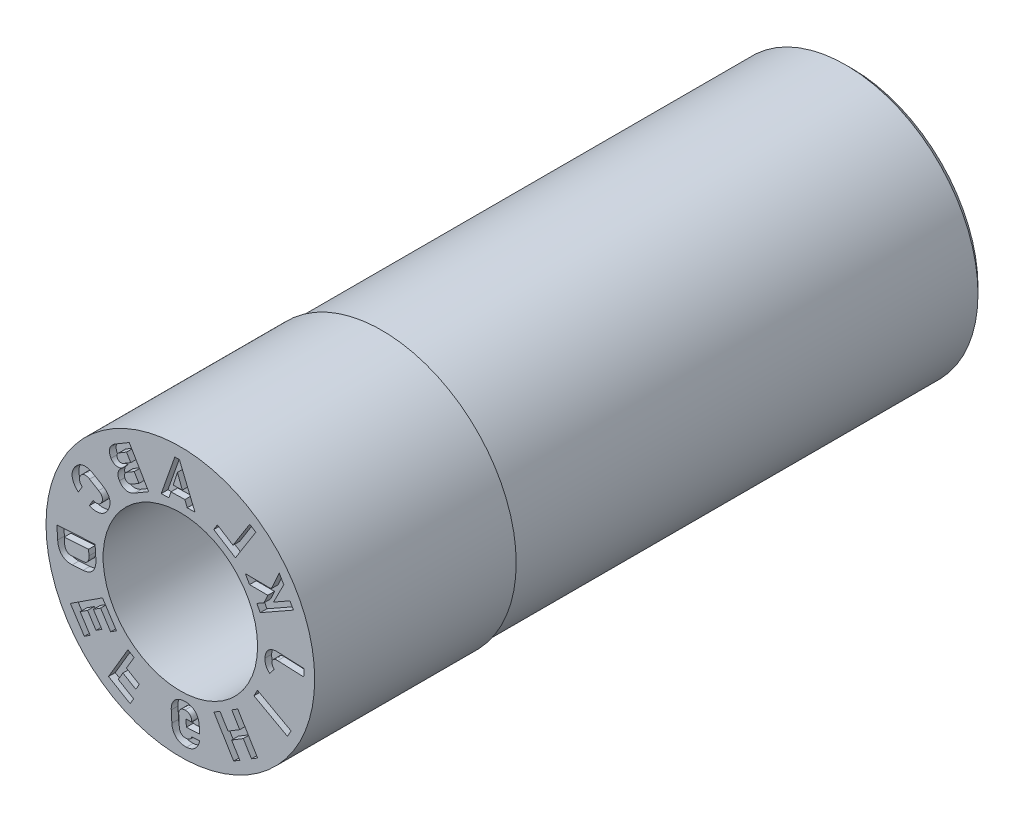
SolidWorks part; units mm, degrees
ref_plane "Front Plane" through (0, 0, 0) normal (0, 0, 1) x (1, 0, 0)
ref_plane "Top Plane" through (0, 0, 0) normal (0, 1, 0) x (1, 0, 0)
ref_plane "Right Plane" through (0, 0, 0) normal (1, 0, 0) x (0, 0, -1)
sketch "Sketch1" plane through (0, 0, 0) normal (1, 0, 0) x (0, 0, -1)
  line L2 (0, 4) -> (0, 2.3)
  line L3 (19.75, 4) -> (0, 4)
  line L4 (-3.7979, 0) -> (49996.2021, 0) construction
  line L8 (16, 1.25) -> (4, 1.25)
  line L9 (4, 2.3) -> (4, 1.25)
  line L10 (4, 2.3) -> (0, 2.3)
  line L12 (20, 2) -> (20, 3.75)
  line L16 (20, 3.75) -> (19.75, 4)
  line L17 (20, 2) -> (16, 2)
  line L18 (16, 1.25) -> (16, 2)
  dimension "D1" = 20
  dimension "D2" = 45
  dimension "D3" = 0.25
  dimension "D4" = 8
  dimension "D5" = 4.6
  dimension "D6" = 4
  dimension "D7" = 2.5
  dimension "D8" = 4
  dimension "D9" = 4
revolve "Revolve1" add sketch "Sketch1" angle 360 about L4
sketch "Sketch4" plane through (0, 0, 0) normal (1, 0, 0) x (0, 0, -1)
  line L0 (0, 0) -> (50000, 0) construction
  line L1 (20, -3.75) -> (20, 3.75) construction
  line L2 (6, 4.935) -> (20, 4.935)
  line L3 (6, 4.935) -> (6, 3.935)
  line L4 (6, 3.935) -> (20, 3.935)
  line L5 (20, 4.935) -> (20, 3.935)
  line L6 (19.75, 4) -> (0, 4) construction
  line L9 (0, 4.4) -> (0, -4.4) construction
  dimension "D1" = 1
  dimension "D2" = 0.065
  dimension "D3" = 6
revolve "Cut-Revolve1" cut sketch "Sketch4" angle 360 about L0
sketch "Sketch2" plane through (0, 0, 0) normal (0, 0, 1) x (1, 0, 0)
  line L0 (0, 0) -> (0, 4) construction
  line L1 (0, 0) -> (2, 3.4641) construction
  line L2 (0, 0) -> (3.4641, 2) construction
  line L3 (0, 0) -> (4, 0) construction
  line L4 (0, 0) -> (3.4641, -2) construction
  line L5 (0, 0) -> (2, -3.4641) construction
  line L6 (0, 0) -> (0, -4) construction
  line L7 (0, 0) -> (-2, -3.4641) construction
  line L8 (0, 0) -> (-3.4641, -2) construction
  line L9 (0, 0) -> (-4, 0) construction
  line L10 (0, 0) -> (-3.4641, 2) construction
  line L11 (0, 0) -> (-2, 3.4641) construction
  line L12 (2.7731, 1.3778) -> (3.0799, 1.9775)
  line L13 (3.0799, 1.9775) -> (2.9468, 2.2119)
  line L14 (2.9468, 2.2119) -> (2.7051, 1.687)
  line L16 (3.3681, 1.4693) -> (3.2625, 1.6554)
  line L17 (3.2625, 1.6554) -> (2.7731, 1.3778)
  line L18 (2.2747, 1.095) -> (2.3803, 0.9089)
  line L19 (2.3803, 0.9089) -> (3.3681, 1.4693)
  line L20 (2.605, 1.4696) -> (2.4884, 1.2163)
  line L21 (2.7051, 1.687) -> (1.9356, 1.6931)
  line L22 (1.9356, 1.6931) -> (2.0608, 1.472)
  line L23 (2.0608, 1.472) -> (2.605, 1.4696)
  line L24 (2.2469, 2.9172) -> (2.0651, 3.0316)
  line L25 (2.0651, 3.0316) -> (1.5681, 2.2422)
  line L26 (-1.3719, 2.6709) -> (-1.2331, 2.4354)
  line L27 (1.6396, 1.9527) -> (2.2469, 2.9172)
  line L28 (1.5681, 2.2422) -> (1.1035, 2.5346)
  line L29 (1.1035, 2.5346) -> (0.9932, 2.3594)
  line L30 (0.9932, 2.3594) -> (1.6396, 1.9527)
  line L31 (-2.5891, -1.491) -> (-2.3746, -1.3517)
  line L32 (-0.0282, 3.6543) -> (-0.1641, 3.6508)
  line L33 (-0.1641, 3.6508) -> (-0.5697, 2.5041)
  line L34 (-0.5697, 2.5041) -> (-0.3392, 2.5099)
  line L35 (-0.3392, 2.5099) -> (-0.2801, 2.6935)
  line L36 (-0.0872, 3.2923) -> (0.0585, 2.9084)
  line L37 (0.2045, 2.5238) -> (0.4348, 2.5296)
  line L38 (0.4348, 2.5296) -> (-0.0282, 3.6543)
  line L39 (0.0585, 2.9084) -> (-0.2131, 2.9016)
  line L40 (-0.2131, 2.9016) -> (-0.0872, 3.2923)
  line L41 (-0.2801, 2.6935) -> (0.1361, 2.704)
  line L42 (0.1361, 2.704) -> (0.2045, 2.5238)
  line L43 (-1.2331, 2.4354) -> (-1.4418, 2.3125)
  line L44 (-1.6433, 2.3507) -> (-1.6446, 2.3528)
  line L45 (-1.5807, 2.548) -> (-1.3719, 2.6709)
  line L46 (-1.6059, -2.5148) -> (-1.3767, -2.1264)
  line L47 (-1.4768, 2.8488) -> (-1.6856, 2.7259)
  line L48 (-1.8093, 2.9358) -> (-1.6005, 3.0587)
  line L49 (1.8746, -2.5902) -> (2.1183, -2.9904)
  line L50 (-1.5209, 3.3453) -> (-1.9201, 3.1101)
  line L51 (-1.814, 2.2157) -> (-1.8128, 2.2137)
  line L52 (-1.3548, 2.1244) -> (-0.944, 2.3664)
  line L53 (1.42, -2.6262) -> (1.1811, -2.2339)
  line L54 (2.4884, 1.2163) -> (2.2747, 1.095)
  line L55 (-1.6005, 3.0587) -> (-1.4768, 2.8488)
  line L57 (-0.944, 2.3664) -> (-1.5209, 3.3453)
  line L58 (-2.3192, 1.8411) -> (-2.5877, 2.0013)
  line L59 (-3.0357, 1.3127) -> (-2.9216, 1.5042)
  line L60 (-2.7017, 1.8101) -> (-2.4332, 1.65)
  line L61 (-2.5985, 1.3114) -> (-2.7125, 1.1199)
  line L62 (-2.7321, -0.013) -> (-2.7216, -0.1795)
  line L63 (-2.902, -0.4133) -> (-3.2368, -0.4346)
  line L64 (-3.4457, -0.2256) -> (-3.4563, -0.0589)
  line L67 (-3.2167, -0.6562) -> (-2.8943, -0.6357)
  line L68 (-2.5154, -0.1609) -> (-2.5391, 0.2145)
  line L70 (-3.6762, 0.1423) -> (-3.6524, -0.2338)
  line L71 (-3.4563, -0.0589) -> (-2.7321, -0.013)
  line L73 (-2.5391, 0.2145) -> (-3.6762, 0.1423)
  line L75 (-2.9839, -1.7475) -> (-2.7628, -1.6039)
  line L77 (-2.318, -1.0584) -> (-3.2746, -1.6798)
  line L78 (-2.3746, -1.3517) -> (-2.0754, -1.8122)
  line L79 (-2.0754, -1.8122) -> (-1.9017, -1.6993)
  line L80 (-1.9017, -1.6993) -> (-2.318, -1.0584)
  line L82 (-2.7628, -1.6039) -> (-2.5106, -1.9921)
  line L83 (-2.5106, -1.9921) -> (-2.337, -1.8792)
  line L84 (-2.337, -1.8792) -> (-2.5891, -1.491)
  line L86 (-3.2746, -1.6798) -> (-2.8584, -2.3207)
  line L87 (-2.8584, -2.3207) -> (-2.6848, -2.2079)
  line L88 (-2.6848, -2.2079) -> (-2.9839, -1.7475)
  line L91 (-1.8492, -2.9273) -> (-1.7106, -2.6924)
  line L92 (-1.3767, -2.1264) -> (-1.5611, -2.0177)
  line L93 (-1.5611, -2.0177) -> (-2.1385, -2.9963)
  line L94 (-1.7106, -2.6924) -> (-1.3262, -2.9191)
  line L95 (-1.3262, -2.9191) -> (-1.2213, -2.7416)
  line L96 (-1.2213, -2.7416) -> (-1.6059, -2.5148)
  line L98 (-2.1385, -2.9963) -> (-1.4959, -3.3755)
  line L99 (-1.4959, -3.3755) -> (-1.3909, -3.1977)
  line L100 (-1.3909, -3.1977) -> (-1.8492, -2.9273)
  line L102 (0.5732, -3.1262) -> (0.5618, -2.9043)
  line L103 (-0.2704, -2.9224) -> (-0.253, -3.2574)
  line L104 (0.5728, -3.3015) -> (0.3417, -3.3136)
  line L105 (-0.0314, -3.246) -> (-0.0487, -2.911)
  line L106 (0.3396, -2.9129) -> (0.3407, -2.9316)
  line L107 (0.3407, -2.9316) -> (0.169, -2.9405)
  line L108 (0.169, -2.9405) -> (0.1796, -3.1466)
  line L109 (0.1796, -3.1466) -> (0.5732, -3.1262)
  line L110 (2.1183, -2.9904) -> (2.3005, -2.8793)
  line L111 (2.3005, -2.8793) -> (1.7109, -1.9112)
  line L112 (1.7109, -1.9112) -> (1.5287, -2.0222)
  line L113 (1.5287, -2.0222) -> (1.7676, -2.4144)
  line L114 (1.5882, -3.3133) -> (1.7707, -3.2021)
  line L115 (1.7707, -3.2021) -> (1.527, -2.8019)
  line L116 (1.1811, -2.2339) -> (0.9986, -2.3451)
  line L117 (0.9986, -2.3451) -> (1.5882, -3.3133)
  line L118 (1.527, -2.8019) -> (1.8746, -2.5902)
  line L120 (1.7676, -2.4144) -> (1.42, -2.6262)
  line L122 (2.2981, -1.1339) -> (2.1911, -1.3288)
  line L123 (2.1911, -1.3288) -> (3.1898, -1.8766)
  line L124 (3.1898, -1.8766) -> (3.2968, -1.6816)
  line L125 (3.2968, -1.6816) -> (2.2981, -1.1339)
  line L126 (2.6618, -0.5134) -> (2.7964, -0.3439)
  line L127 (2.8993, -0.0689) -> (3.6733, -0.1021)
  line L128 (3.6733, -0.1021) -> (3.6828, 0.1196)
  line L129 (3.6828, 0.1196) -> (2.9079, 0.1529)
  circle A0 centre (0, 0) radius 2.5697 construction
  circle A1 centre (0, 0) radius 4 construction
  spline S0 degree 3 poles (-1.4418, 2.3125) (-1.4607, 2.3014) (-1.4898, 2.2879) (-1.5302, 2.2823) (-1.5577, 2.2843) (-1.5835, 2.2922) (-1.6155, 2.3115) (-1.6335, 2.3342) (-1.6433, 2.3507) knots 0 0 0 0 0.283466 0.405841 0.522926 0.636679 0.750166 1 1 1 1
  spline S1 degree 3 poles (-1.6446, 2.3528) (-1.6516, 2.3642) (-1.6594, 2.3823) (-1.6655, 2.4071) (-1.6666, 2.4251) (-1.6652, 2.4427) (-1.6611, 2.4599) (-1.654, 2.4765) (-1.6443, 2.4925) (-1.6321, 2.5078) (-1.6118, 2.5279) (-1.5935, 2.5401) (-1.5807, 2.548) knots 0 0 0 0 0.17252 0.25126 0.328092 0.403193 0.478339 0.55421 0.634683 0.71825 0.806214 1 1 1 1
  spline S2 degree 3 poles (-1.6856, 2.7259) (-1.7028, 2.716) (-1.7292, 2.7038) (-1.7661, 2.6992) (-1.7912, 2.7018) (-1.8148, 2.7096) (-1.8443, 2.7284) (-1.8613, 2.7497) (-1.8704, 2.7655) knots 0 0 0 0 0.27852 0.399107 0.515068 0.629067 0.743549 1 1 1 1
  spline S3 degree 3 poles (-1.8704, 2.7655) (-1.8786, 2.7798) (-1.8881, 2.8029) (-1.8886, 2.8352) (-1.8831, 2.8581) (-1.8722, 2.88) (-1.8495, 2.9087) (-1.8263, 2.9258) (-1.8093, 2.9358) knots 0 0 0 0 0.242796 0.354569 0.467184 0.584762 0.709338 1 1 1 1
  spline S4 degree 3 poles (-1.9201, 3.1101) (-1.9496, 3.0929) (-1.9906, 3.0641) (-2.0367, 3.019) (-2.0643, 2.9843) (-2.0857, 2.948) (-2.1013, 2.9104) (-2.1104, 2.8715) (-2.1135, 2.8316) (-2.1102, 2.791) (-2.0976, 2.7346) (-2.0788, 2.6942) (-2.0634, 2.6682) knots 0 0 0 0 0.194804 0.283138 0.366342 0.445821 0.522265 0.597031 0.672265 0.748964 0.827958 1 1 1 1
  spline S5 degree 3 poles (-2.0634, 2.6682) (-2.0528, 2.6501) (-2.0346, 2.6249) (-2.005, 2.597) (-1.9816, 2.5797) (-1.9564, 2.5662) (-1.9299, 2.5557) (-1.9018, 2.5491) (-1.8725, 2.546) (-1.8421, 2.5466) (-1.7992, 2.5515) (-1.7675, 2.5615) (-1.7464, 2.5691) knots 0 0 0 0 0.172307 0.253422 0.332614 0.410524 0.487832 0.566051 0.646395 0.729514 0.815295 1 1 1 1
  spline S6 degree 3 poles (-1.7464, 2.5691) (-1.7652, 2.5544) (-1.791, 2.5303) (-1.8182, 2.4934) (-1.8345, 2.4652) (-1.8464, 2.4357) (-1.8548, 2.4056) (-1.8583, 2.3747) (-1.8577, 2.3433) (-1.8534, 2.3114) (-1.8408, 2.2677) (-1.8265, 2.2359) (-1.814, 2.2157) knots 0 0 0 0 0.179879 0.263735 0.345125 0.424727 0.502552 0.579734 0.658108 0.738676 0.821711 1 1 1 1
  spline S7 degree 3 poles (-1.8128, 2.2137) (-1.7973, 2.1875) (-1.7708, 2.1513) (-1.7276, 2.1122) (-1.6932, 2.0898) (-1.6566, 2.073) (-1.618, 2.0621) (-1.5774, 2.0575) (-1.5351, 2.059) (-1.4912, 2.0662) (-1.4293, 2.085) (-1.3842, 2.1067) (-1.3548, 2.1244) knots 0 0 0 0 0.172171 0.251961 0.328616 0.403963 0.478875 0.554883 0.634593 0.717961 0.805685 1 1 1 1
  spline S8 degree 3 poles (-2.1654, 1.2689) (-2.1547, 1.287) (-2.1398, 1.3142) (-2.1241, 1.3516) (-2.1141, 1.3789) (-2.1062, 1.406) (-2.0998, 1.4328) (-2.0958, 1.4595) (-2.0937, 1.4859) (-2.0936, 1.5119) (-2.095, 1.5375) (-2.0989, 1.5627) (-2.1046, 1.5874) (-2.1121, 1.6117) (-2.1215, 1.6356) (-2.1328, 1.659) (-2.1462, 1.6818) (-2.1613, 1.7042) (-2.1785, 1.7257) (-2.1975, 1.7467) (-2.2181, 1.767) (-2.2406, 1.7867) (-2.2738, 1.8123) (-2.3003, 1.8302) (-2.3192, 1.8411) knots 0 0 0 0 0.093395 0.137867 0.180685 0.222706 0.263356 0.30334 0.342595 0.381331 0.419141 0.456735 0.494484 0.53194 0.569988 0.608498 0.647681 0.687739 0.728571 0.77031 0.813445 0.857468 0.903297 1 1 1 1
  spline S9 degree 3 poles (-2.5877, 2.0013) (-2.6063, 2.0124) (-2.6344, 2.0276) (-2.6728, 2.0445) (-2.7007, 2.055) (-2.7285, 2.0634) (-2.7559, 2.0705) (-2.7831, 2.0749) (-2.8099, 2.0778) (-2.8363, 2.0785) (-2.8623, 2.0774) (-2.8879, 2.0746) (-2.9128, 2.0695) (-2.9373, 2.0628) (-2.9611, 2.054) (-2.9847, 2.0436) (-3.0075, 2.031) (-3.0298, 2.0166) (-3.0514, 2.0005) (-3.0723, 1.9824) (-3.0922, 1.9624) (-3.1116, 1.9407) (-3.1367, 1.9088) (-3.1538, 1.883) (-3.1645, 1.8649) knots 0 0 0 0 0.096419 0.14217 0.186461 0.229443 0.271255 0.312127 0.351941 0.391171 0.429722 0.467793 0.505489 0.542813 0.580646 0.618521 0.657329 0.6966 0.736521 0.777346 0.819285 0.862414 0.90656 1 1 1 1
  spline S10 degree 3 poles (-3.1645, 1.8649) (-3.1817, 1.8355) (-3.2036, 1.7896) (-3.219, 1.7248) (-3.2241, 1.6767) (-3.2227, 1.6285) (-3.215, 1.5805) (-3.2004, 1.5332) (-3.1797, 1.4865) (-3.1528, 1.4406) (-3.1075, 1.3796) (-3.0659, 1.3386) (-3.0357, 1.3127) knots 0 0 0 0 0.164359 0.242523 0.319819 0.396758 0.474197 0.553045 0.634665 0.719808 0.808406 1 1 1 1
  spline S11 degree 3 poles (-2.9216, 1.5042) (-2.9346, 1.5169) (-2.9534, 1.5362) (-2.9731, 1.565) (-2.985, 1.5864) (-2.9939, 1.608) (-3.0008, 1.6295) (-3.004, 1.6512) (-3.0051, 1.6726) (-3.0034, 1.6939) (-2.9965, 1.7222) (-2.9878, 1.7424) (-2.98, 1.755) knots 0 0 0 0 0.195176 0.28654 0.37324 0.456219 0.536212 0.614028 0.690102 0.765908 0.841951 1 1 1 1
  spline S12 degree 3 poles (-2.98, 1.755) (-2.9706, 1.7712) (-2.9541, 1.7933) (-2.9275, 1.8172) (-2.9067, 1.8312) (-2.8845, 1.8413) (-2.861, 1.8477) (-2.8364, 1.8506) (-2.8106, 1.8499) (-2.7842, 1.8451) (-2.7465, 1.8345) (-2.7196, 1.8204) (-2.7017, 1.8101) knots 0 0 0 0 0.174816 0.254583 0.331752 0.4066 0.480982 0.557388 0.636835 0.719716 0.807055 1 1 1 1
  spline S13 degree 3 poles (-2.4332, 1.65) (-2.4154, 1.6394) (-2.3908, 1.6219) (-2.3631, 1.5944) (-2.3466, 1.5732) (-2.3338, 1.5511) (-2.3248, 1.528) (-2.3195, 1.5043) (-2.3178, 1.4799) (-2.32, 1.455) (-2.3284, 1.4202) (-2.3404, 1.3952) (-2.35, 1.3791) knots 0 0 0 0 0.192502 0.280292 0.362664 0.441768 0.517825 0.592476 0.667438 0.744799 0.824735 1 1 1 1
  spline S14 degree 3 poles (-2.35, 1.3791) (-2.3578, 1.3663) (-2.371, 1.3482) (-2.3931, 1.3289) (-2.4109, 1.3168) (-2.4303, 1.3074) (-2.4509, 1.2997) (-2.473, 1.2956) (-2.4961, 1.2934) (-2.5204, 1.2937) (-2.5551, 1.2981) (-2.5811, 1.3054) (-2.5985, 1.3114) knots 0 0 0 0 0.160081 0.236116 0.312169 0.388724 0.466101 0.54522 0.627432 0.713977 0.803689 1 1 1 1
  spline S15 degree 3 poles (-2.7125, 1.1199) (-2.6752, 1.106) (-2.6192, 1.089) (-2.544, 1.0782) (-2.4909, 1.0765) (-2.4399, 1.0801) (-2.3915, 1.09) (-2.3458, 1.1058) (-2.3028, 1.1273) (-2.2627, 1.1544) (-2.2134, 1.1991) (-2.1828, 1.2396) (-2.1654, 1.2689) knots 0 0 0 0 0.192102 0.280672 0.365808 0.447541 0.526353 0.603189 0.680187 0.757178 0.835634 1 1 1 1
  spline S16 degree 3 poles (-2.7216, -0.1795) (-2.7204, -0.1962) (-2.7203, -0.2206) (-2.7238, -0.252) (-2.7279, -0.2736) (-2.7338, -0.2939) (-2.7415, -0.3127) (-2.7505, -0.3303) (-2.7618, -0.3461) (-2.7741, -0.3607) (-2.7882, -0.3735) (-2.8037, -0.3844) (-2.8204, -0.394) (-2.8388, -0.4015) (-2.866, -0.4091) (-2.8873, -0.4126) (-2.902, -0.4133) knots 0 0 0 0 0.149294 0.217742 0.282769 0.345755 0.405751 0.464546 0.52215 0.57888 0.635526 0.691381 0.748399 0.807473 0.868753 1 1 1 1
  spline S17 degree 3 poles (-3.2368, -0.4346) (-3.2515, -0.4354) (-3.2732, -0.4354) (-3.301, -0.4308) (-3.3202, -0.4255) (-3.3382, -0.4186) (-3.355, -0.4095) (-3.3705, -0.3985) (-3.3848, -0.3858) (-3.3976, -0.3712) (-3.4092, -0.3552) (-3.4189, -0.3374) (-3.4273, -0.3181) (-3.4343, -0.2973) (-3.4415, -0.2665) (-3.4446, -0.2422) (-3.4457, -0.2256) knots 0 0 0 0 0.131519 0.193026 0.251708 0.30885 0.36554 0.42164 0.478419 0.536186 0.594485 0.654943 0.717185 0.782386 0.850943 1 1 1 1
  spline S18 degree 3 poles (-3.6524, -0.2338) (-3.651, -0.2567) (-3.6475, -0.2903) (-3.6396, -0.334) (-3.6323, -0.3647) (-3.624, -0.3942) (-3.6138, -0.422) (-3.6025, -0.4486) (-3.5898, -0.4737) (-3.5757, -0.4973) (-3.5602, -0.5194) (-3.5435, -0.5398) (-3.5254, -0.5587) (-3.5062, -0.576) (-3.4855, -0.5915) (-3.4639, -0.6058) (-3.4407, -0.6181) (-3.4164, -0.6289) (-3.391, -0.638) (-3.3645, -0.6455) (-3.337, -0.6511) (-3.3083, -0.6548) (-3.2681, -0.658) (-3.2374, -0.6573) (-3.2167, -0.6562) knots 0 0 0 0 0.099679 0.146986 0.192765 0.23677 0.279908 0.32155 0.362267 0.402245 0.440933 0.479288 0.516785 0.554393 0.591617 0.629153 0.667044 0.705465 0.744616 0.784244 0.824866 0.866686 0.909637 1 1 1 1
  spline S19 degree 3 poles (-2.8943, -0.6357) (-2.8745, -0.6343) (-2.8453, -0.6314) (-2.8075, -0.6231) (-2.7804, -0.6162) (-2.7546, -0.6071) (-2.7297, -0.5971) (-2.7061, -0.5851) (-2.6834, -0.5719) (-2.662, -0.5571) (-2.6417, -0.5408) (-2.6231, -0.5228) (-2.6056, -0.5037) (-2.5896, -0.4828) (-2.5752, -0.4603) (-2.5618, -0.4365) (-2.5502, -0.4112) (-2.5398, -0.3845) (-2.5311, -0.3565) (-2.5245, -0.327) (-2.519, -0.2963) (-2.5155, -0.2643) (-2.5133, -0.219) (-2.514, -0.1843) (-2.5154, -0.1609) knots 0 0 0 0 0.086349 0.127733 0.168295 0.207935 0.246696 0.284917 0.323012 0.360849 0.398334 0.43588 0.473323 0.51131 0.550096 0.589379 0.629887 0.671531 0.713883 0.757464 0.802694 0.849518 0.897782 1 1 1 1
  spline S20 degree 3 poles (0.5618, -2.9043) (0.561, -2.8837) (0.5574, -2.8535) (0.5504, -2.8142) (0.543, -2.7862) (0.5348, -2.7591) (0.5244, -2.7331) (0.5127, -2.708) (0.4995, -2.684) (0.4847, -2.6614) (0.4689, -2.6399) (0.4515, -2.6201) (0.4332, -2.6014) (0.4133, -2.5846) (0.3923, -2.569) (0.3701, -2.5547) (0.3465, -2.5422) (0.322, -2.5312) (0.2966, -2.5214) (0.2702, -2.5138) (0.243, -2.5079) (0.2151, -2.5032) (0.1761, -2.5001) (0.1464, -2.4996) (0.1264, -2.5009) knots 0 0 0 0 0.092097 0.136211 0.179282 0.221701 0.263437 0.304593 0.345671 0.386224 0.42581 0.465274 0.504135 0.54305 0.582251 0.621436 0.661363 0.701669 0.742217 0.783216 0.824693 0.866914 0.910217 1 1 1 1
  spline S21 degree 3 poles (0.1264, -2.5009) (0.1062, -2.5017) (0.0766, -2.5052) (0.038, -2.5123) (0.0104, -2.5191) (-0.0161, -2.5275) (-0.0416, -2.5375) (-0.0663, -2.5487) (-0.0897, -2.5617) (-0.112, -2.576) (-0.1333, -2.5912) (-0.1527, -2.6082) (-0.1711, -2.6258) (-0.1877, -2.6452) (-0.2031, -2.6654) (-0.2172, -2.6869) (-0.2295, -2.7097) (-0.2405, -2.7334) (-0.25, -2.758) (-0.2574, -2.7835) (-0.2636, -2.8097) (-0.2679, -2.8367) (-0.2715, -2.8743) (-0.2714, -2.903) (-0.2704, -2.9224) knots 0 0 0 0 0.092708 0.137257 0.180688 0.223164 0.265201 0.306518 0.347867 0.388514 0.428457 0.467954 0.507099 0.545772 0.584963 0.624108 0.663987 0.70393 0.744417 0.785028 0.826231 0.868082 0.910763 1 1 1 1
  spline S22 degree 3 poles (-0.253, -3.2574) (-0.2523, -3.278) (-0.2487, -3.3081) (-0.2417, -3.3475) (-0.2343, -3.3755) (-0.226, -3.4026) (-0.2157, -3.4286) (-0.204, -3.4536) (-0.1908, -3.4774) (-0.1759, -3.4999) (-0.1602, -3.5213) (-0.143, -3.5411) (-0.1244, -3.5596) (-0.1048, -3.5767) (-0.0836, -3.592) (-0.0614, -3.6063) (-0.0379, -3.6191) (-0.0133, -3.6301) (0.0121, -3.6396) (0.0384, -3.6472) (0.0655, -3.6532) (0.0934, -3.6577) (0.1324, -3.661) (0.162, -3.6614) (0.182, -3.6601) knots 0 0 0 0 0.092204 0.13637 0.179491 0.22196 0.263744 0.304949 0.345757 0.38605 0.425682 0.465193 0.503831 0.543042 0.582057 0.621287 0.661455 0.701807 0.742251 0.783298 0.824494 0.867099 0.910112 1 1 1 1
  spline S23 degree 3 poles (0.182, -3.6601) (0.2148, -3.6587) (0.2633, -3.6508) (0.3246, -3.6301) (0.3676, -3.6097) (0.4074, -3.5843) (0.444, -3.5548) (0.4766, -3.521) (0.5053, -3.4832) (0.5297, -3.442) (0.5559, -3.3822) (0.5683, -3.3344) (0.5728, -3.3015) knots 0 0 0 0 0.170673 0.253471 0.33582 0.417619 0.498386 0.579483 0.661511 0.744468 0.827803 1 1 1 1
  spline S24 degree 3 poles (0.3417, -3.3136) (0.3383, -3.3254) (0.3319, -3.343) (0.3184, -3.3636) (0.3068, -3.378) (0.2934, -3.391) (0.2784, -3.4022) (0.2626, -3.4127) (0.2452, -3.4209) (0.2272, -3.4278) (0.2025, -3.435) (0.1832, -3.4374) (0.1704, -3.4382) knots 0 0 0 0 0.163455 0.244229 0.325903 0.408113 0.491213 0.573955 0.659013 0.744804 0.829004 1 1 1 1
  spline S25 degree 3 poles (0.1704, -3.4382) (0.1524, -3.4391) (0.1256, -3.438) (0.092, -3.4287) (0.0687, -3.4192) (0.0474, -3.4063) (0.0283, -3.3906) (0.0117, -3.3721) (-0.0028, -3.3512) (-0.0141, -3.3276) (-0.0268, -3.293) (-0.03, -3.2649) (-0.0314, -3.246) knots 0 0 0 0 0.172173 0.253423 0.332967 0.412052 0.4903 0.568352 0.64925 0.732831 0.817999 1 1 1 1
  spline S26 degree 3 poles (-0.0487, -2.911) (-0.0499, -2.8942) (-0.0481, -2.8692) (-0.0394, -2.8376) (-0.0299, -2.8159) (-0.0173, -2.796) (-0.0023, -2.778) (0.0159, -2.7628) (0.0363, -2.7495) (0.0589, -2.7388) (0.0926, -2.7274) (0.1197, -2.7241) (0.138, -2.7228) knots 0 0 0 0 0.169385 0.249139 0.328273 0.406733 0.484577 0.563071 0.6442 0.728311 0.814246 1 1 1 1
  spline S27 degree 3 poles (0.138, -2.7228) (0.1562, -2.722) (0.1832, -2.723) (0.2173, -2.7314) (0.2406, -2.7408) (0.2618, -2.7531) (0.2809, -2.768) (0.2974, -2.7863) (0.3116, -2.807) (0.3228, -2.8304) (0.335, -2.8653) (0.3385, -2.8936) (0.3396, -2.9129) knots 0 0 0 0 0.174321 0.255811 0.335717 0.412952 0.489703 0.567216 0.647166 0.729162 0.81493 1 1 1 1
  spline S28 degree 3 poles (2.5196, -0.1934) (2.5182, -0.2266) (2.5208, -0.2757) (2.5351, -0.3384) (2.5512, -0.3814) (2.5718, -0.421) (2.6058, -0.4682) (2.6379, -0.4975) (2.6618, -0.5134) knots 0 0 0 0 0.271973 0.400312 0.525574 0.647267 0.765611 1 1 1 1
  spline S29 degree 3 poles (2.7964, -0.3439) (2.785, -0.3344) (2.7698, -0.3182) (2.7535, -0.2937) (2.7436, -0.2742) (2.7358, -0.2539) (2.7289, -0.2261) (2.7271, -0.2048) (2.728, -0.1906) knots 0 0 0 0 0.255231 0.381316 0.506998 0.632723 0.755324 1 1 1 1
  spline S30 degree 3 poles (2.728, -0.1906) (2.7288, -0.1721) (2.7343, -0.1443) (2.755, -0.1142) (2.7752, -0.096) (2.8003, -0.0823) (2.8418, -0.0698) (2.8758, -0.0676) (2.8993, -0.0689) knots 0 0 0 0 0.235579 0.344935 0.456481 0.574963 0.702365 1 1 1 1
  spline S31 degree 3 poles (2.9079, 0.1529) (2.8713, 0.1548) (2.8177, 0.152) (2.7498, 0.1371) (2.7118, 0.1229) (2.6837, 0.1091) (2.6643, 0.0972) (2.6455, 0.0846) (2.6286, 0.07) (2.6125, 0.0547) (2.5974, 0.0381) (2.5839, 0.0199) (2.5714, 0.0007) (2.5604, -0.0197) (2.5506, -0.0413) (2.5422, -0.0639) (2.5349, -0.0876) (2.5291, -0.1125) (2.5229, -0.1478) (2.5204, -0.175) (2.5196, -0.1934) knots 0 0 0 0 0.185997 0.270621 0.35164 0.390622 0.429278 0.467346 0.504968 0.542395 0.580108 0.618424 0.656924 0.69617 0.736012 0.777014 0.8186 0.861699 0.906468 1 1 1 1
  point P19 (0, 0)
  point P668 (0, 0.0063)
  point P669 (0.0063, 0.0063)
  point P670 (0.0063, 0)
  dimension "D1" = 12
extrude "Cut-Extrude1" cut sketch "Sketch2" against normal blind 0.2
sketch "Sketch3" plane through (0, 0, -4) normal (0, 0, 1) x (1, 0, 0)
  line L0 (0, 0) -> (0, 50000) construction
  line L1 (0.7217, 1.25) -> (-0.7217, 1.25)
  line L2 (-0.7217, 1.25) -> (-1.4434, 0)
  line L3 (-1.4434, 0) -> (-0.7217, -1.25)
  line L4 (-0.7217, -1.25) -> (0.7217, -1.25)
  line L5 (0.7217, -1.25) -> (1.4434, 0)
  line L6 (1.4434, 0) -> (0.7217, 1.25)
  line L7 (0, 0) -> (50000, 0) construction
  circle A0 centre (0, 0) radius 1.25 construction
  circle A1 centre (0, 0) radius 1.25 construction
extrude "Cut-Extrude2" cut sketch "Sketch3" against normal blind 2
